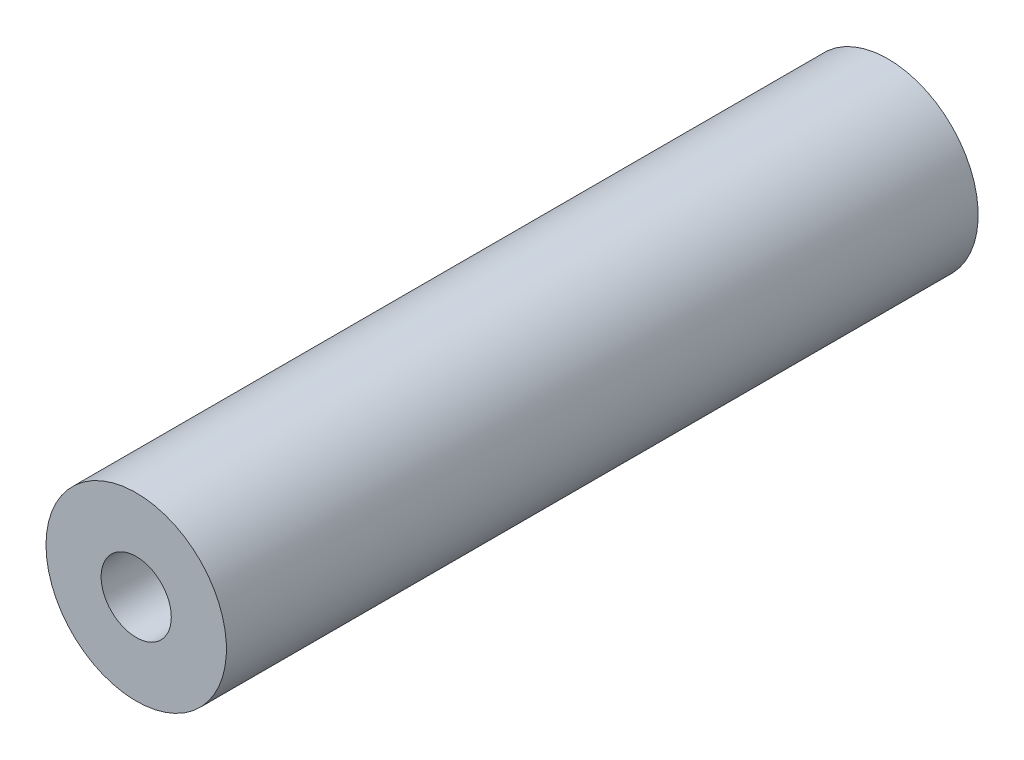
SolidWorks part; units mm, degrees
ref_plane "Plano frontal" through (0, 0, 0) normal (0, 0, 1) x (1, 0, 0)
ref_plane "Plano superior" through (0, 0, 0) normal (0, 1, 0) x (1, 0, 0)
ref_plane "Plano direito" through (0, 0, 0) normal (1, 0, 0) x (0, 0, -1)
sketch "Esboço1" plane through (0, 0, 0) normal (0, 0, 1) x (1, 0, 0)
  circle A0 centre (0, 0) radius 5.4
  dimension "D1" = 10.8
extrude "Ressalto-extrusão1" add sketch "Esboço1" along normal blind 45
hole_wizard "Furo roscado de M51" positions "3DSketch1" profile "Esboço2" tap size "M5" standard "ISO"
sketch3d "3DSketch1"
  line L0 (0, 0, 45) -> (0, 0, 0) construction
  point P0 (0, 0, 0)
  point P5 (0, 0, 45)
sketch "Esboço2" plane through (0, 0, 45) normal (1, 0, 0) x (0, -1, 0)
  line L0 (0, 0) -> (0, 15.2618)
  line L1 (0, 15.2618) -> (2.1, 14)
  line L2 (2.1, 14) -> (2.1, 0)
  line L5 (2.1, 0) -> (0, 0)
  line L10 (0, 15.2618) -> (-2.1, 14) construction
  line L11 (0, -6.35) -> (0, 107.95) construction
  dimension "Tap Drill Dia." = 4.2
  dimension "Tap Drill Depth" = 14
  dimension "Drill Angle" = 118
sketch "Esboço3" plane through (0, 0, 0) normal (0, 0, -1) x (-1, 0, 0)
  line L0 (-3, 0) -> (3, 0) construction
  circle A0 centre (0, 0) radius 3 construction
  point P3 (0, 3)
  point P9 (0, 0)
  point P10 (0, 0)
  point P11 (0, 0)
  dimension "D1" = 6
hole_wizard "Furo roscado de M21" positions "3DSketch2" profile "Esboço6" tap size "M2" standard "ISO"
sketch3d "3DSketch2"
  point P0 (0, 3, 0)
sketch "Esboço6" plane through (0, 3, 0) normal (1, 0, 0) x (0, 1, 0)
  line L0 (0, 0) -> (0, 8.4807)
  line L1 (0, 8.4807) -> (0.8, 8)
  line L2 (0.8, 8) -> (0.8, 0)
  line L5 (0.8, 0) -> (0, 0)
  line L10 (0, 8.4807) -> (-0.8, 8) construction
  line L11 (0, -6.35) -> (0, 107.95) construction
  dimension "Tap Drill Dia." = 1.6
  dimension "Tap Drill Depth" = 8
  dimension "Drill Angle" = 118
pattern_circular "PadrãoCircular1" count 3 over 360 about axis through (0, 0, 0) along (0, 0, 1) of "Furo roscado de M21"
